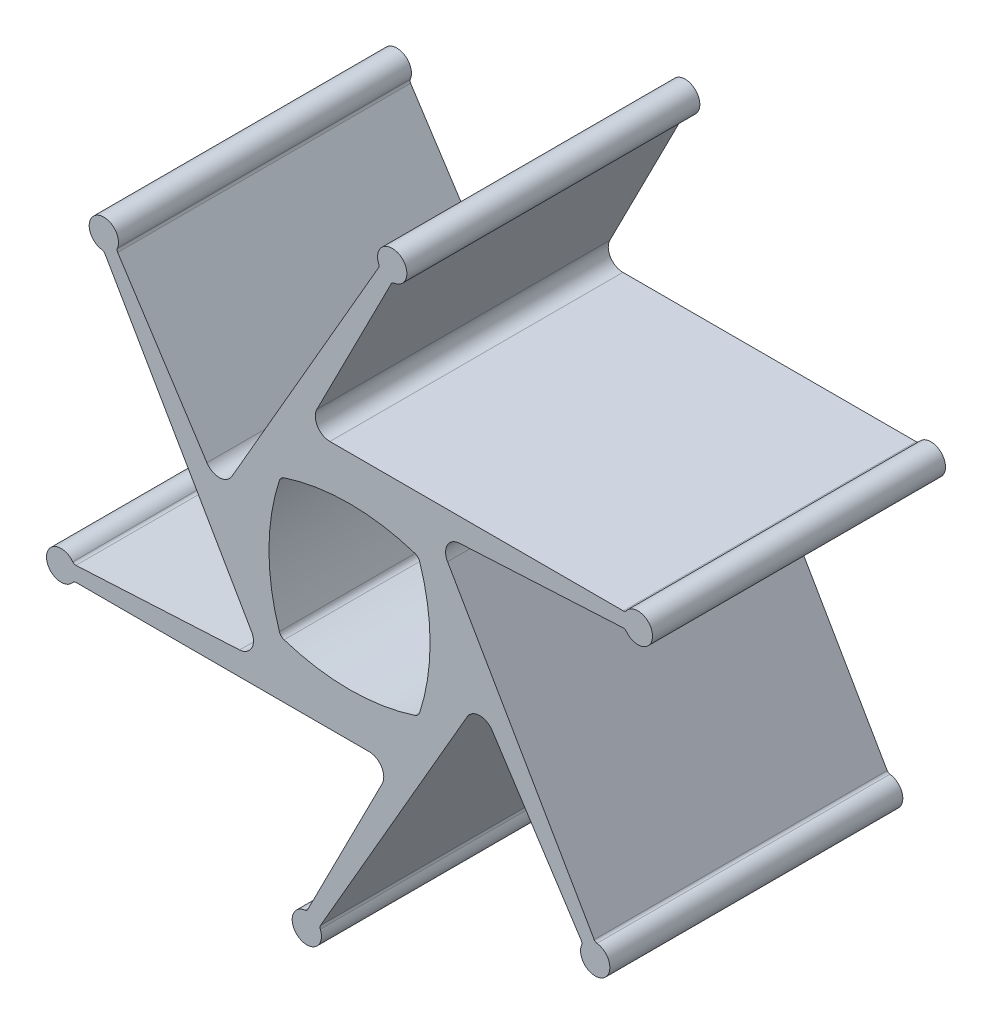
SolidWorks part; units mm, degrees
ref_plane "Plan de face" through (0, 0, 0) normal (0, 0, 1) x (1, 0, 0)
ref_plane "Plan de dessus" through (0, 0, 0) normal (0, 1, 0) x (1, 0, 0)
ref_plane "Plan de droite" through (0, 0, 0) normal (1, 0, 0) x (0, 0, -1)
sketch "Esquisse1" plane through (0, 0, 0) normal (0, 0, 1) x (1, 0, 0)
  line L0 (-16.2664, 6.1832) -> (3.7578, 40.8662)
  line L1 (-37.5641, -14.9851) -> (-15.2186, -13.8141)
  line L2 (-13.5912, -10.8168) -> (-33.6154, 23.8662)
  line L3 (-31.8627, 24.8602) -> (-19.6758, 6.0939)
  line L4 (2.4689, -17) -> (-37.5796, -17)
  line L5 (5.495, 39.8453) -> (-4.6636, 19.908)
  line L6 (-2.8816, 17) -> (37.1669, 17)
  line L7 (37.1514, 14.9851) -> (14.8058, 13.8141)
  line L8 (13.1785, 10.8168) -> (33.2027, -23.8662)
  line L9 (31.45, -24.8602) -> (19.2631, -6.0939)
  line L10 (15.8537, -6.1832) -> (-4.1705, -40.8662)
  line L11 (-5.9077, -39.8453) -> (4.2509, -19.908)
  arc A0 (4.2509, -19.908) -> (2.4689, -17) centre (2.4689, -19) ccw
  arc A1 (-37.5796, -17) -> (-37.9796, -17.2) centre (-37.5796, -17.5) ccw
  arc A2 (-37.9881, -14.7887) -> (-37.5641, -14.9851) centre (-37.5903, -14.4858) ccw
  arc A3 (-33.6154, 23.8662) -> (-33.9886, 24.1126) centre (-34.0484, 23.6162) ccw
  arc A4 (-31.9046, 25.3256) -> (-31.8627, 24.8602) centre (-31.4434, 25.1325) ccw
  arc A5 (-37.9881, -14.7887) -> (-37.9796, -17.2) centre (-39.5796, -16) ccw
  arc A6 (-15.2186, -13.8141) -> (-13.5912, -10.8168) centre (-15.3232, -11.8168) ccw
  arc A7 (-31.9046, 25.3256) -> (-33.9886, 24.1126) centre (-33.7494, 26.0982) ccw
  arc A8 (-19.6758, 6.0939) -> (-16.2664, 6.1832) centre (-17.9984, 7.1832) ccw
  arc A9 (5.8772, 40.1143) -> (5.495, 39.8453) centre (5.9405, 39.6183) ccw
  arc A10 (3.7578, 40.8662) -> (3.7846, 41.3126) centre (3.3248, 41.1162) ccw
  arc A11 (5.8772, 40.1143) -> (3.7846, 41.3126) centre (5.6238, 42.0982) ccw
  arc A12 (37.5754, 14.7887) -> (37.1514, 14.9851) centre (37.1776, 14.4858) ccw
  arc A13 (37.1669, 17) -> (37.5669, 17.2) centre (37.1669, 17.5) ccw
  arc A14 (37.5754, 14.7887) -> (37.5669, 17.2) centre (39.1669, 16) ccw
  arc A15 (33.2027, -23.8662) -> (33.5759, -24.1126) centre (33.6357, -23.6162) ccw
  arc A16 (31.4919, -25.3256) -> (31.45, -24.8602) centre (31.0307, -25.1325) ccw
  arc A17 (-4.1705, -40.8662) -> (-4.1973, -41.3126) centre (-3.7375, -41.1162) ccw
  arc A18 (-6.2899, -40.1143) -> (-5.9077, -39.8453) centre (-6.3532, -39.6183) ccw
  arc A19 (19.2631, -6.0939) -> (15.8537, -6.1832) centre (17.5857, -7.1832) ccw
  arc A20 (14.8058, 13.8141) -> (13.1785, 10.8168) centre (14.9105, 11.8168) ccw
  arc A21 (-4.6636, 19.908) -> (-2.8816, 17) centre (-2.8816, 19) ccw
  arc A22 (31.4919, -25.3256) -> (33.5759, -24.1126) centre (33.3367, -26.0982) ccw
  arc A23 (-6.2899, -40.1143) -> (-4.1973, -41.3126) centre (-6.0366, -42.0982) ccw
  arc A24 (9.3696, 8.9363) -> (8.7299, 9.5759) centre (8.4191, 8.6254) ccw
  arc A25 (8.7299, -9.5759) -> (9.3696, -8.9363) centre (8.4191, -8.6254) ccw
  arc A26 (-9.7823, -8.9363) -> (-9.1426, -9.5759) centre (-8.8318, -8.6254) ccw
  arc A27 (-9.1426, 9.5759) -> (-9.7823, 8.9363) centre (-8.8318, 8.6254) ccw
  arc A28 (-9.1426, -9.5759) -> (8.7299, -9.5759) centre (-0.2064, 17.75) ccw
  arc A29 (9.3696, -8.9363) -> (9.3696, 8.9363) centre (-17.9564, 0) ccw
  arc A30 (8.7299, 9.5759) -> (-9.1426, 9.5759) centre (-0.2064, -17.75) ccw
  arc A31 (-9.7823, 8.9363) -> (-9.7823, -8.9363) centre (17.5436, 0) ccw
extrude "Extrusion1" add sketch "Esquisse1" along normal blind 40
sketch "Esquisse2" plane through (0, 0, 0) normal (0, 1, 0) x (1, 0, 0)
  line L0 (0, 0) -> (0, -50.0131) construction
